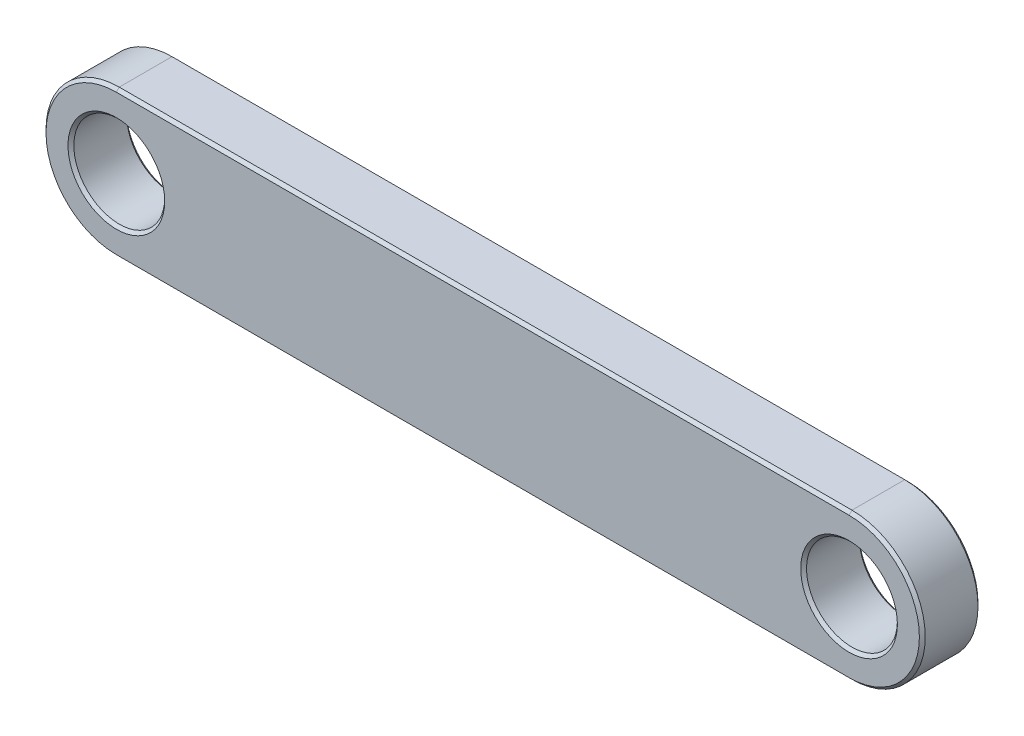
SolidWorks part; units mm, degrees
ref_plane "Front Plane" through (0, 0, 0) normal (0, 0, 1) x (1, 0, 0)
ref_plane "Top Plane" through (0, 0, 0) normal (0, 1, 0) x (1, 0, 0)
ref_plane "Right Plane" through (0, 0, 0) normal (1, 0, 0) x (0, 0, -1)
sketch "Sketch1" plane through (0, 0, 0) normal (0, 0, 1) x (1, 0, 0)
  line L0 (12.5, 0) -> (-12.5, 0) construction
  line L1 (12.5, -2.5) -> (-12.5, -2.5)
  line L2 (12.5, 2.5) -> (-12.5, 2.5)
  arc A0 (12.5, -2.5) -> (12.5, 2.5) centre (12.5, 0) ccw
  arc A1 (-12.5, 2.5) -> (-12.5, -2.5) centre (-12.5, 0) ccw
  circle A2 centre (-12.5, 0) radius 1.55
  circle A3 centre (12.5, 0) radius 1.55
  point P2 (0, 0)
  dimension "D3" = 3.1
  dimension "D4" = 3.1
  dimension "D1" = 25
  dimension "D2" = 5
extrude "Boss-Extrude1" add sketch "Sketch1" along normal blind 2
chamfer "Chamfer1" distance 0.1 angle 45 12 edges at (14.05, 0, 0) (-10.95, 0, 0) (0, 2.5, 0) (-15, 0, 0) (0, -2.5, 0) (15, 0, 0) (14.05, 0, 2) (0, -2.5, 2) (-15, 0, 2) (0, 2.5, 2) (15, 0, 2) (-10.95, 0, 2)
